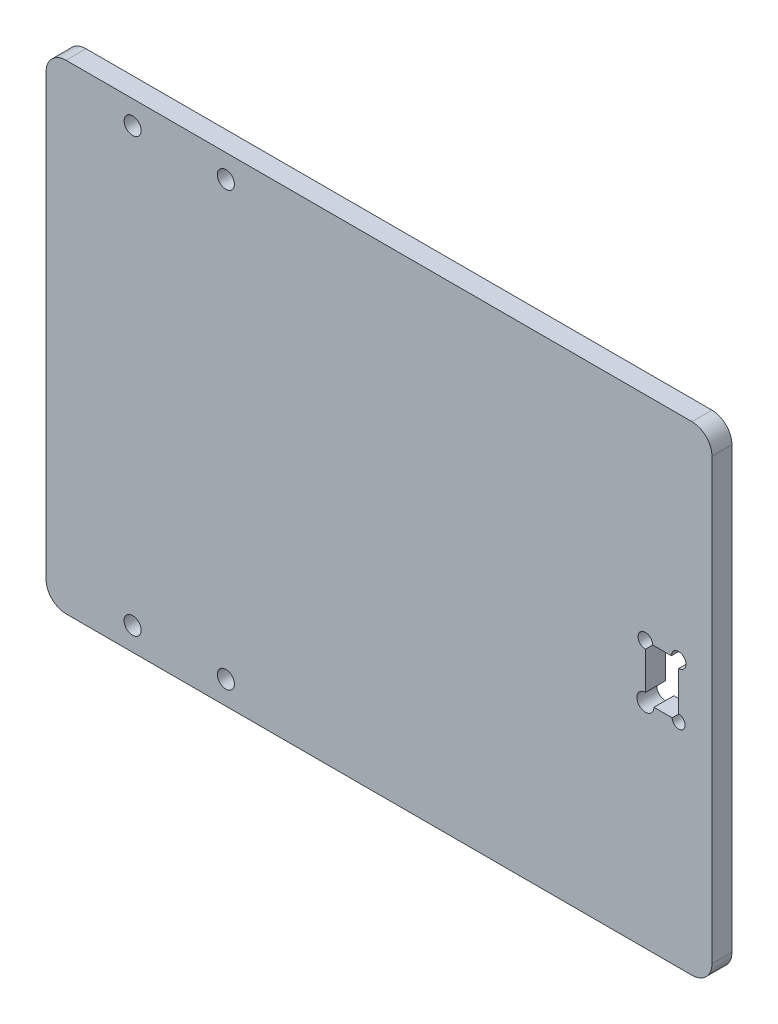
SolidWorks part; units mm, degrees
ref_plane "Plan de face" through (0, 0, 0) normal (0, 0, 1) x (1, 0, 0)
ref_plane "Plan de dessus" through (0, 0, 0) normal (0, 1, 0) x (1, 0, 0)
ref_plane "Plan de droite" through (0, 0, 0) normal (1, 0, 0) x (0, 0, -1)
sketch "Esquisse1" plane through (0, 0, 0) normal (0, 0, 1) x (1, 0, 0)
  line L1 (3, 0) -> (97, 0)
  line L2 (0, 3) -> (0, 69)
  line L3 (3, 72) -> (97, 72)
  line L4 (100, 3) -> (100, 69)
  arc A0 (3, 72) -> (0, 69) centre (3, 69) ccw
  arc A1 (100, 69) -> (97, 72) centre (97, 69) ccw
  arc A2 (97, 0) -> (100, 3) centre (97, 3) ccw
  arc A3 (0, 3) -> (3, 0) centre (3, 3) ccw
  point P7 (0, 72)
  point P10 (100, 72)
  point P15 (0, 0)
  dimension "D3" = 3
  dimension "D1" = 100
  dimension "D2" = 72
extrude "Extrusion1" add sketch "Esquisse1" along normal blind 3
sketch "Esquisse2" plane through (0, 0, 3) normal (0, 0, 1) x (1, 0, 0)
  line L0 (50, 72) -> (50, 0) construction
  line L1 (97, 72) -> (3, 72) construction
  line L2 (3, 0) -> (97, 0) construction
  line L3 (0, 36) -> (100, 36) construction
  line L5 (90, 40) -> (95, 40)
  line L6 (90, 40) -> (90, 32)
  line L7 (90, 32) -> (95, 32)
  line L8 (0, 69) -> (0, 3) construction
  line L9 (100, 3) -> (100, 69) construction
  line L10 (95, 40) -> (95, 32)
  dimension "D3" = 5
  dimension "D1" = 8
  dimension "D2" = 5
extrude "Enlèv. mat.-Extru.1" cut sketch "Esquisse2" against normal through all
sketch "Esquisse3" plane through (0, 0, 3) normal (0, 0, 1) x (1, 0, 0)
  line L0 (20, 0) -> (20, 72) construction
  line L1 (3, 0) -> (97, 0) construction
  line L2 (97, 72) -> (3, 72) construction
  line L3 (5.0091, 68.5) -> (28.5671, 68.5) construction
  line L4 (5.0091, 3.5) -> (25.0455, 3.5) construction
  line L5 (0, 36) -> (100, 36) construction
  line L6 (0, 69) -> (0, 3) construction
  line L7 (100, 3) -> (100, 69) construction
  circle A0 centre (13, 68.5) radius 1.2816
  circle A1 centre (27, 68.5) radius 1.2816
  circle A2 centre (27, 3.5) radius 1.2816
  circle A3 centre (13, 3.5) radius 1.2816
  circle A4 centre (90, 40) radius 1.0981
  circle A5 centre (95, 40) radius 1.1
  circle A6 centre (95, 32) radius 0.9787
  circle A7 centre (90, 32) radius 1.2884
  dimension "D2" = 2.2
  dimension "D3" = 14
  dimension "D1" = 3.5
  dimension "D4" = 20
extrude "Enlèv. mat.-Extru.2" cut sketch "Esquisse3" against normal through all
